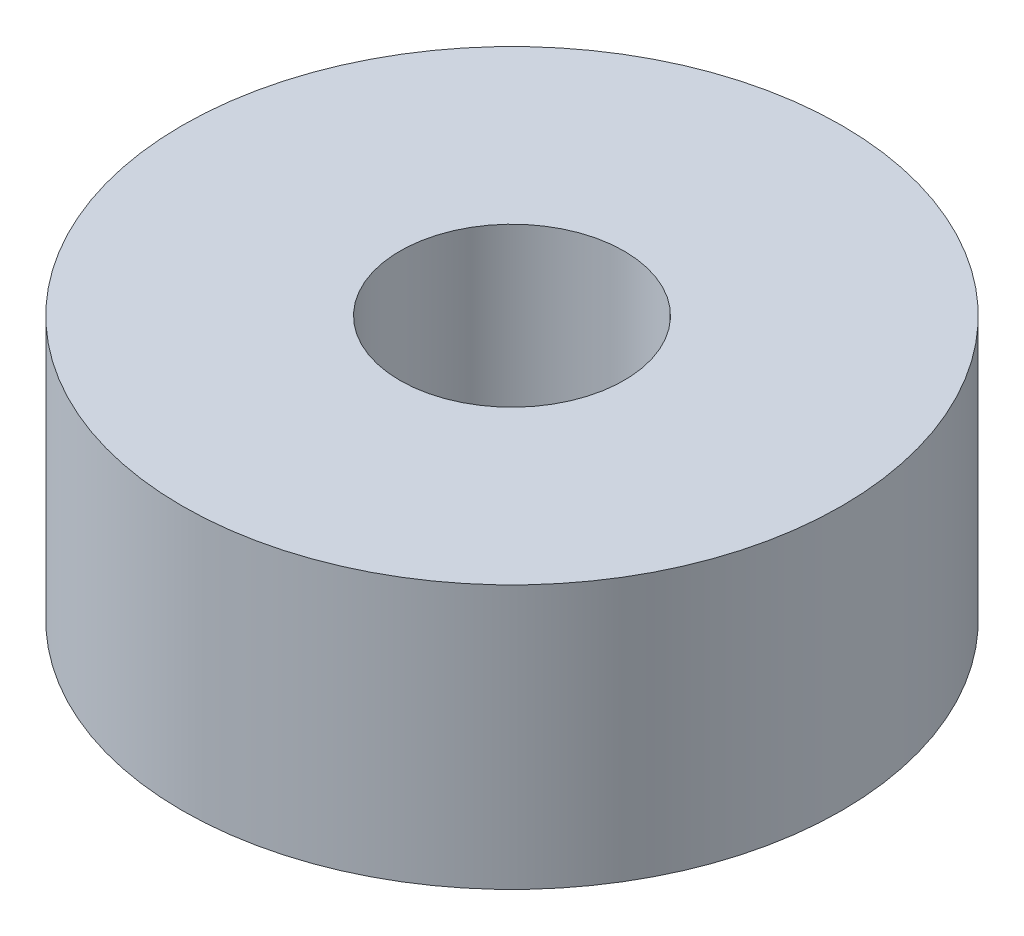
SolidWorks part; units mm, degrees
ref_plane "Plan de face" through (0, 0, 0) normal (0, 0, 1) x (1, 0, 0)
ref_plane "Plan de dessus" through (0, 0, 0) normal (0, 1, 0) x (1, 0, 0)
ref_plane "Plan de droite" through (0, 0, 0) normal (1, 0, 0) x (0, 0, -1)
sketch "Esquisse1" plane through (0, 0, 0) normal (0, 1, 0) x (1, 0, 0)
  circle A0 centre (0, 0) radius 12.5
  circle A1 centre (0, 0) radius 4.25
  dimension "D1" = 25
  dimension "D2" = 8.5
extrude "Extrusion1" add sketch "Esquisse1" along normal mid plane 10
